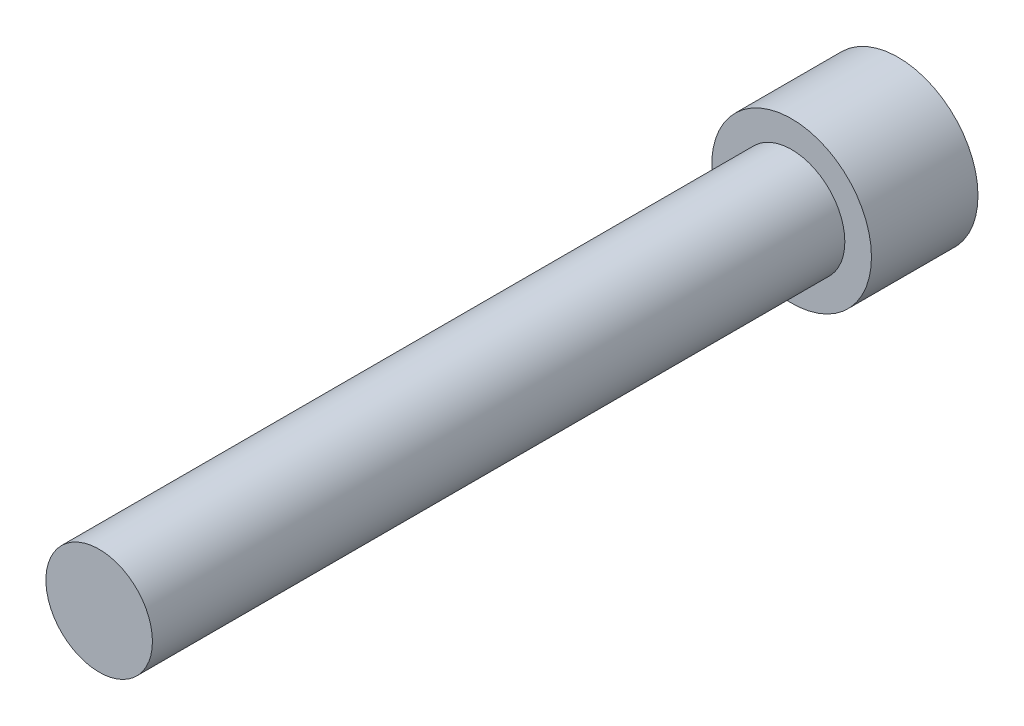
SolidWorks part; units mm, degrees
ref_plane "Front Plane" through (0, 0, 0) normal (0, 0, 1) x (1, 0, 0)
ref_plane "Top Plane" through (0, 0, 0) normal (0, 1, 0) x (1, 0, 0)
ref_plane "Right Plane" through (0, 0, 0) normal (1, 0, 0) x (0, 0, -1)
sketch "Sketch6" plane through (0, 0, 0) normal (1, 0, 0) x (0, 0, -1)
  line L0 (-41.275, 0) -> (22.525, 0) construction
  line L1 (5.2388, 0) -> (-5.2388, 0) construction
  line L2 (-41.275, 0) -> (-41.275, -3.175)
  line L3 (-41.275, -3.175) -> (0, -3.175)
  line L4 (0, 5.2388) -> (0, -5.2388) construction
  line L5 (0, -3.175) -> (0, -4.7625)
  line L6 (0, -4.7625) -> (6.35, -4.7625)
  line L7 (6.35, -4.7625) -> (6.35, 0)
  line L8 (6.35, 0) -> (-41.275, 0)
  dimension "L" = 41.275
  dimension "H" = 6.35
  dimension "A" = 9.525
  dimension "D" = 6.35
revolve "Revolve1" add sketch "Sketch6" angle 360 about L0
sketch "Sketch7" plane through (0, 0, -6.35) normal (0, 0, -1) x (-1, 0, 0)
  line L2 (-2.3876, 1.3785) -> (-2.3876, -1.3785)
  line L4 (-2.3876, -1.3785) -> (0, -2.757)
  line L5 (0, -2.757) -> (2.3876, -1.3785)
  line L6 (2.3876, -1.3785) -> (2.3876, 1.3785)
  line L7 (2.3876, 1.3785) -> (0, 2.757)
  line L8 (0, 2.757) -> (-2.3876, 1.3785)
  circle A0 centre (0, 0) radius 2.3876 construction
  dimension "J" = 4.7752
extrude "HEX" cut sketch "Sketch7" against normal blind 3.556
